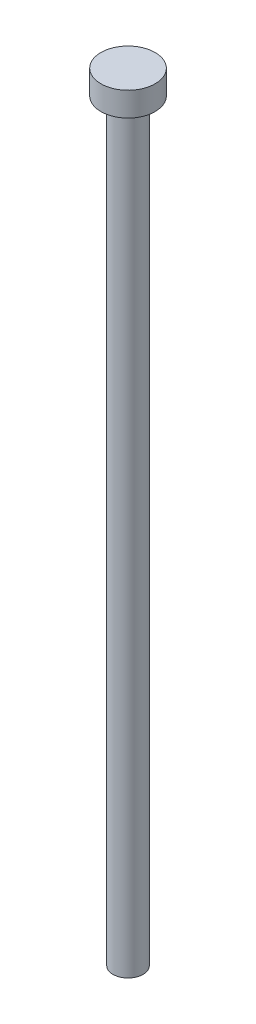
SolidWorks part; units mm, degrees
ref_plane "Front Plane" through (0, 0, 0) normal (0, 0, 1) x (1, 0, 0)
ref_plane "Top Plane" through (0, 0, 0) normal (0, 1, 0) x (1, 0, 0)
ref_plane "Right Plane" through (0, 0, 0) normal (1, 0, 0) x (0, 0, -1)
sketch "Sketch1" plane through (0, 0, 0) normal (0, 0, 1) x (1, 0, 0)
  line L0 (0, 0) -> (0, 65.532)
  line L1 (0, 65.532) -> (2.286, 65.532)
  line L2 (2.286, 65.532) -> (2.286, 63.5)
  line L3 (2.286, 63.5) -> (1.27, 63.5)
  line L4 (1.27, 63.5) -> (1.27, 0)
  line L5 (1.27, 0) -> (0, 0)
  dimension "D1" = 2.286
  dimension "D2" = 2.032
  dimension "D3" = 63.5
  dimension "D4" = 1.27
revolve "Revolve1" add sketch "Sketch1" angle 360 about L0
